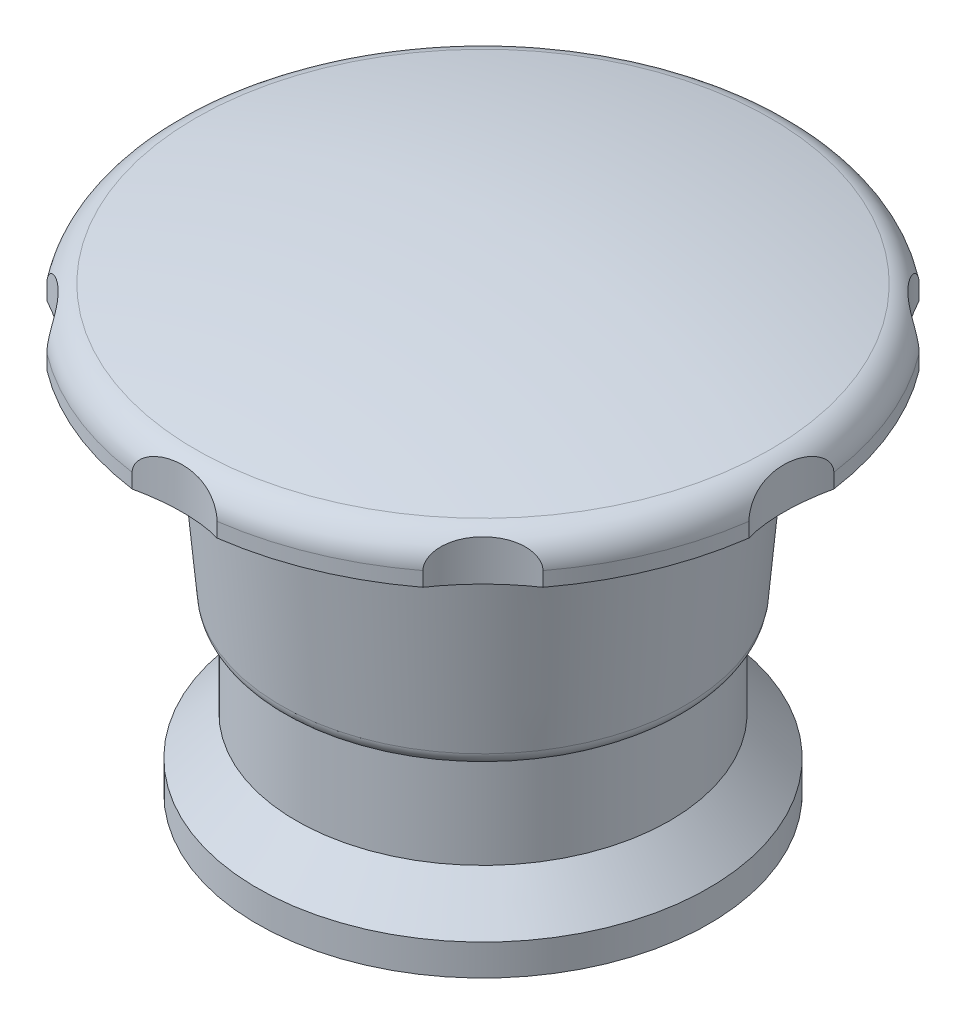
SolidWorks part; units mm, degrees
ref_plane "Plan de face" through (0, 0, 0) normal (0, 0, 1) x (1, 0, 0)
ref_plane "Plan de dessus" through (0, 0, 0) normal (0, 1, 0) x (1, 0, 0)
ref_plane "Plan de droite" through (0, 0, 0) normal (1, 0, 0) x (0, 0, -1)
sketch "Esquisse1" plane through (0, 0, 0) normal (0, 0, 1) x (1, 0, 0)
  line L0 (0, 0) -> (-14.5, 0)
  line L1 (-14.5, 0) -> (-14.5, 2)
  line L2 (-14.5, 2) -> (-12, 4.5)
  line L3 (-12, 4.5) -> (-12, 10.5)
  line L4 (-12.9962, 11.4128) -> (-13.9681, 22.5214)
  line L5 (-15.4428, 24.2789) -> (-20, 25.5)
  line L6 (-20, 25.5) -> (-20, 26.4288)
  line L7 (0, 30.5) -> (0, 0)
  line L8 (0, 0) -> (0, -50.75) construction
  arc A0 (-12, 10.5) -> (-12.9962, 11.4128) centre (-12, 11.5) cw
  arc A1 (0, 30.5) -> (-18.4543, 28.3765) centre (0, -50.75) ccw
  arc A2 (-13.9681, 22.5214) -> (-15.4428, 24.2789) centre (-15.9605, 22.3471) ccw
  arc A3 (-20, 26.4288) -> (-18.4543, 28.3765) centre (-18, 26.4288) cw
  point P17 (-20, 28)
  dimension "D5" = 1
  dimension "D13" = 2
  dimension "D14" = 2
  dimension "D1" = 14.5
  dimension "D2" = 2
  dimension "D3" = 45
  dimension "D4" = 12
  dimension "D6" = 10.5
  dimension "D7" = 5
  dimension "D8" = 75
  dimension "D9" = 30.5
  dimension "D10" = 20
  dimension "D11" = 5
  dimension "D12" = 2.5
revolve "Révolution1" add sketch "Esquisse1" angle 360 about L8
sketch "Esquisse2" plane through (0, 0, 0) normal (0, -1, 0) x (1, 0, 0)
  line L0 (0, 26.8) -> (0, 19.3) construction
  line L1 (0, 19.3) -> (0, 0) construction
  circle A0 centre (0, 26.8) radius 7.5
  dimension "D2" = 15
  dimension "D1" = 19.3
extrude "Enlèv. mat.-Extru.1" cut sketch "Esquisse2" against normal blind 50
pattern_circular "Répétition circulaire1" count 8 over 360 about axis through (0, 0, 0) along (0, 1, 0) of "Enlèv. mat.-Extru.1"
